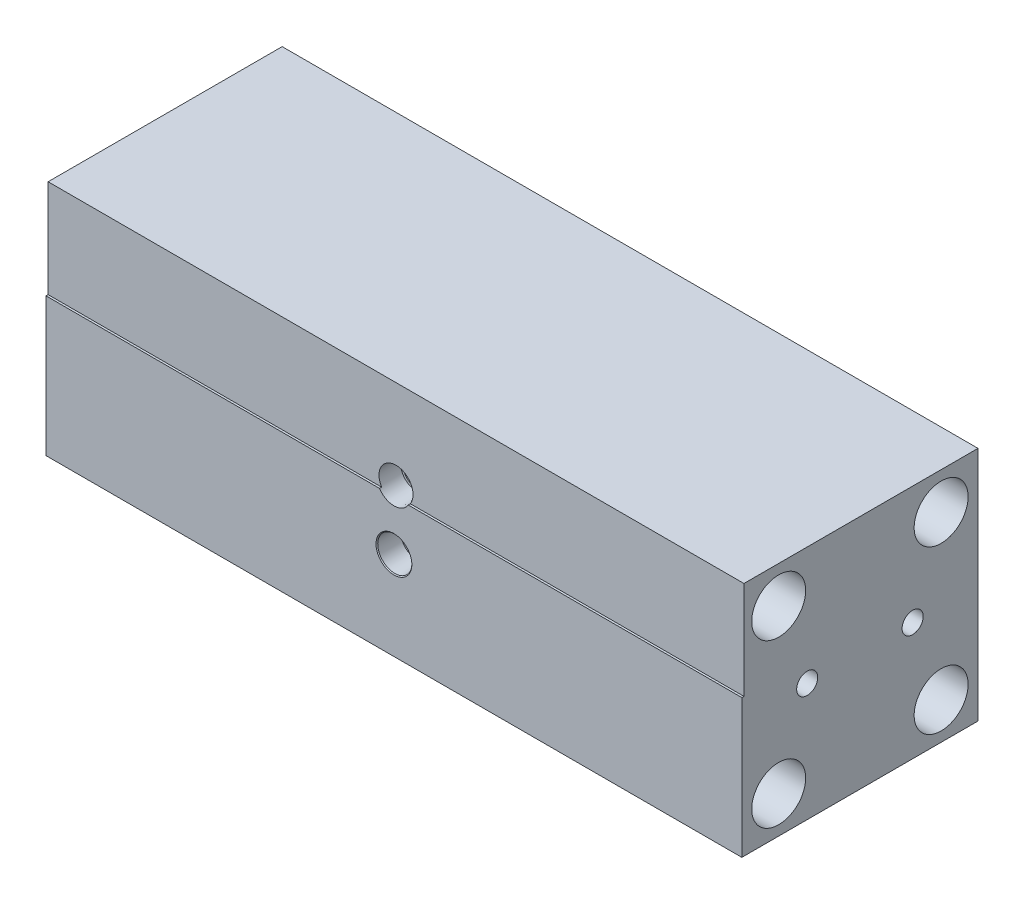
SolidWorks part; units mm, degrees
ref_plane "Front Plane" through (0, 0, 0) normal (0, 0, 1) x (1, 0, 0)
ref_plane "Top Plane" through (0, 0, 0) normal (0, 1, 0) x (1, 0, 0)
ref_plane "Right Plane" through (0, 0, 0) normal (1, 0, 0) x (0, 0, -1)
sketch "Sketch1" plane through (0, 0, 0) normal (0, 0, 1) x (1, 0, 0)
  line L0 (-104.775, -35.56) -> (104.775, -35.56)
  line L1 (104.775, -35.56) -> (104.775, 35.56)
  line L2 (104.775, 35.56) -> (-104.775, 35.56)
  line L3 (-104.775, 35.56) -> (-104.775, -35.56)
  line L4 (-104.775, 35.56) -> (104.775, -35.56) construction
  dimension "D1" = 209.55
  dimension "D2" = 71.12
extrude "Extrude1" add sketch "Sketch1" along normal mid plane 71.12
sketch "Sketch18" plane through (104.775, 0, 0) normal (1, 0, 0) x (0, 0, -1)
  line L0 (-35.56, 35.56) -> (-35.56, 6.1214)
  line L1 (-35.56, 6.1214) -> (-34.925, 6.1214)
  line L2 (-34.925, 6.1214) -> (-34.925, 35.56)
  line L3 (-34.925, 35.56) -> (-35.56, 35.56)
  line L4 (-35.56, 35.56) -> (35.56, 35.56) construction
  line L5 (-35.56, -35.56) -> (-35.56, 35.56) construction
  dimension "D1" = 29.4386
  dimension "D2" = 0.635
  dimension "D3" = 34.925
extrude "Cut-Extrude1" cut sketch "Sketch18" against normal through all
hole_wizard "1/4-20 Tapped Hole1" positions "Sketch20" profile "Sketch19" tap size "1/4-20" standard "ANSI Inch"
sketch "Sketch20" plane through (0.5389, -35.56, 6.9814) normal (0, 1, 0) x (1, 0, 0)
  line L1 (-64.0389, 6.9814) -> (-38.6389, 6.9814) construction
  line L3 (37.5611, 6.9814) -> (62.9611, 6.9814) construction
  line L4 (-38.6389, 6.9814) -> (-25.9389, 6.9814) construction
  line L5 (-25.9389, 6.9814) -> (24.8611, 6.9814) construction
  line L6 (24.8611, 6.9814) -> (37.5611, 6.9814) construction
  point P0 (-64.0389, 6.9814)
  point P2 (62.9611, 6.9814)
  point P9 (-38.6389, 6.9814)
  point P11 (37.5611, 6.9814)
  point P25 (-25.9389, 6.9814)
  point P27 (24.8611, 6.9814)
  dimension "D1" = 127
  dimension "D2" = 76.2
  dimension "D3" = 50.8
sketch "Sketch19" plane through (-63.5, -35.56, 0) normal (1, 0, 0) x (0, 0, -1)
  line L0 (0, 0) -> (0, 15.834)
  line L1 (0, 15.834) -> (2.5527, 14.3002)
  line L2 (2.5527, 14.3002) -> (2.5527, 0)
  line L5 (2.5527, 0) -> (0, 0)
  line L10 (0, 15.834) -> (-2.5527, 14.3002) construction
  line L11 (0, -6.35) -> (0, 107.95) construction
  dimension "Tap Drill Dia." = 5.1054
  dimension "Tap Drill Depth" = 14.3002
  dimension "Drill Angle" = 118
hole_wizard "Hole1" positions "Sketch22" profile "Sketch21" legacy
sketch "Sketch22" plane through (-46.1336, -35.56, -8.9694) normal (0, 1, 0) x (1, 0, 0)
  line L0 (-4.6664, -8.9694) -> (96.9336, -8.9694) construction
  point P0 (-4.6664, -8.9694)
  point P2 (96.9336, -8.9694)
  dimension "D1" = 101.6
sketch "Sketch21" plane through (-50.8, -35.56, 0) normal (1, 0, 0) x (0, 0, -1)
  line L0 (0, 0) -> (0, 8.2577)
  line L1 (0, 8.2577) -> (3.175, 6.35)
  line L2 (3.175, 6.35) -> (3.175, 0)
  line L4 (3.175, 0) -> (0, 0)
  line L6 (0, 8.2577) -> (-3.175, 6.35) construction
  line L7 (0, -4.2442) -> (0, 117.3081) construction
  dimension "Diameter" = 6.35
  dimension "Depth" = 6.35
  dimension "Drill Angle" = 118
hole_wizard "1/8 NPT Tapped Hole1" positions "Sketch24" profile "Sketch23" size "1/8" standard "ANSI Inch"
sketch "Sketch24" plane through (0, 0, 35.56) normal (0, 0, 1) x (1, 0, 0)
  line L0 (-104.775, -35.56) -> (104.775, -35.56) construction
  point P0 (0, -8.89)
  point P2 (0, 8.89)
  dimension "D1" = 17.78
  dimension "D4" = 26.67
sketch "Sketch23" plane through (0, -8.89, 35.56) normal (1, 0, 0) x (0, -1, 0)
  line L0 (0, 0) -> (0, 14.1667)
  line L1 (4.2164, 11.6332) -> (0, 14.1667)
  line L2 (-4.2164, 11.6332) -> (0, 14.1667) construction
  line L3 (4.2164, 11.6332) -> (4.2164, 6.9342)
  line L4 (4.2164, 6.9342) -> (4.9362, 6.9342)
  line L5 (4.9362, 6.9342) -> (5.1438, 0)
  line L6 (-4.9362, 6.9342) -> (-5.1438, 0) construction
  line L7 (5.1438, 0) -> (0, 0)
  line L8 (0, -6.35) -> (0, 107.95) construction
  line L11 (-4.2164, 6.9342) -> (-4.9362, 6.9342) construction
  dimension "Tap Drill Dia." = 8.4328
  dimension "Tap Drill Depth" = 11.6332
  dimension "Thread Dia." = 10.2876
  dimension "Thread Angle" = 3.43
  dimension "Thread Depth" = 6.9342
  dimension "Drill Angle" = 118
hole_wizard "1/4-20 Tapped Hole2" positions "Sketch26" profile "Sketch25" tap size "1/4-20" standard "ANSI Inch"
sketch "Sketch26" plane through (0, 0, -35.56) normal (0, 0, -1) x (-1, 0, 0)
  line L0 (-76.2, 10.16) -> (76.2, 10.16) construction
  line L1 (-76.2, 10.16) -> (-76.2, -10.16) construction
  line L2 (-76.2, -10.16) -> (76.2, 10.16) construction
  point P0 (-76.2, 10.16)
  point P2 (76.2, 10.16)
  point P11 (-76.2, -10.16)
  point P13 (76.2, -10.16)
  dimension "D1" = 152.4
  dimension "D2" = 20.32
sketch "Sketch25" plane through (76.2, 10.16, -35.56) normal (1, 0, 0) x (0, 1, 0)
  line L0 (0, 0) -> (0, 17.4088)
  line L1 (0, 17.4088) -> (2.5527, 15.875)
  line L2 (2.5527, 15.875) -> (2.5527, 0)
  line L5 (2.5527, 0) -> (0, 0)
  line L10 (0, 17.4088) -> (-2.5527, 15.875) construction
  line L11 (0, -6.35) -> (0, 107.95) construction
  dimension "Tap Drill Dia." = 5.1054
  dimension "Tap Drill Depth" = 15.875
  dimension "Drill Angle" = 118
hole_wizard "Hole2" positions "Sketch28" profile "Sketch27" legacy
sketch "Sketch28" plane through (0, 0, -35.56) normal (0, 0, -1) x (-1, 0, 0)
  line L2 (-63.5, -10.16) -> (63.5, 10.16) construction
  point P0 (63.5, 10.16)
  point P2 (-63.5, -10.16)
  dimension "D1" = 127
  dimension "D2" = 20.32
sketch "Sketch27" plane through (-63.5, 10.16, -35.56) normal (1, 0, 0) x (0, 1, 0)
  line L0 (0, 0) -> (0, 8.2577)
  line L1 (0, 8.2577) -> (3.175, 6.35)
  line L2 (3.175, 6.35) -> (3.175, 0)
  line L4 (3.175, 0) -> (0, 0)
  line L6 (0, 8.2577) -> (-3.175, 6.35) construction
  line L7 (0, -4.2442) -> (0, 117.3081) construction
  dimension "Diameter" = 6.35
  dimension "Depth" = 6.35
  dimension "Drill Angle" = 118
sketch "Sketch29" plane through (104.775, 0, 0) normal (1, 0, 0) x (0, 0, -1)
  line L0 (-24.4602, 24.4602) -> (24.4602, -24.4602) construction
  line L1 (-15.875, 0) -> (15.875, 0) construction
  circle A0 centre (-24.4602, 24.4602) radius 8.128
  circle A1 centre (24.4602, 24.4602) radius 8.128
  circle A2 centre (-24.4602, -24.4602) radius 8.128
  circle A3 centre (24.4602, -24.4602) radius 8.128
  circle A4 centre (-15.875, 0) radius 3.175
  circle A5 centre (15.875, 0) radius 3.175
  dimension "D1" = 48.9204
  dimension "D2" = 48.9204
  dimension "D3" = 16.256
  dimension "D4" = 6.35
  dimension "D5" = 31.75
extrude "Cut-Extrude2" cut sketch "Sketch29" against normal through all
chamfer "Chamfer1" distance 0.254 angle 45 15 edges at (-78.7527, 10.16, -35.56) (60.325, -10.16, -35.56) (-66.675, 10.16, -35.56) (73.6473, 10.16, -35.56) (5.1438, -8.89, 35.56) (-78.7527, -10.16, -35.56) (73.6473, -10.16, -35.56) (63.5, -35.56, -2.5527) (50.8, -35.56, -3.175) (38.1, -35.56, -2.5527) (-38.1, -35.56, -2.5527) (-50.8, -35.56, -3.175) (-63.5, -35.56, -2.5527) (25.4, -35.56, -2.5527) (-25.4, -35.56, -2.5527)
